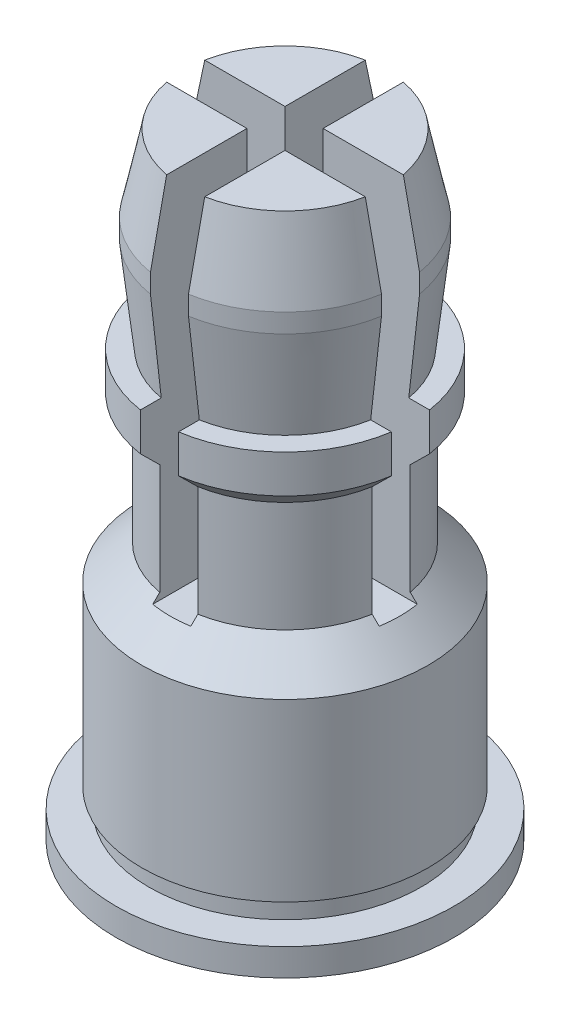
SolidWorks part; units mm, degrees
ref_plane "Plane1" through (0, 0, 0) normal (0, 0, 1) x (1, 0, 0)
ref_plane "Plane2" through (0, 0, 0) normal (0, 1, 0) x (1, 0, 0)
ref_plane "Plane3" through (0, 0, 0) normal (1, 0, 0) x (0, 0, -1)
sketch "BodySke" plane through (0, 0, 0) normal (0, 0, 1) x (1, 0, 0)
  line L0 (2.5555, 0.51) -> (2.5555, 0.8925)
  line L1 (2.69, 4.1891) -> (2.0272, 4.8518)
  line L3 (2.0272, 4.8518) -> (2.0272, 6.9267)
  line L4 (0, 0) -> (3.175, 0)
  line L5 (3.175, 0) -> (3.175, 0.51)
  line L6 (3.175, 0.51) -> (2.5555, 0.51)
  line L7 (2.385, 7.2845) -> (2.385, 8)
  line L8 (2.69, 0.8925) -> (2.69, 4.1891)
  line L9 (0, 0) -> (0, 17.145) construction
  line L10 (2.385, 8) -> (2, 8)
  line L11 (2, 8) -> (2.2, 9.79)
  line L12 (2.2, 9.79) -> (2.2, 10.148)
  line L13 (2.2, 10.148) -> (1.9, 11.58)
  line L14 (1.9, 11.58) -> (0, 11.58)
  line L15 (2.5555, 0.8925) -> (2.69, 0.8925)
  line L17 (0, 11.58) -> (0, 0)
  line L19 (2.385, 7.2845) -> (2.0272, 6.9267)
  dimension "D1" = 315
  dimension "H_dia" = 6.35
  dimension "T_ht" = 0.51
  dimension "C_dia" = 5.38
  dimension "Groove_dia" = 5.111
  dimension "Groove_wid" = 0.3825
  dimension "Length" = 8
  dimension "D_ht" = 3.58
  dimension "Neck_dia" = 4.0545
  dimension "B_dia" = 4.77
  dimension "B_ht" = 0.7155
  dimension "Panel_dia" = 4
  dimension "Slip_dia" = 4.4
  dimension "Tip_dia" = 3.8
  dimension "Grip_ht" = 1.79
  dimension "Slip_ht" = 0.358
  dimension "Neck_len" = 3.1482
revolve "Body" add sketch "BodySke" angle 360 about L9
sketch "SlitCutSke" plane through (0, 11.58, 0) normal (0, 1, 0) x (-1, 0, 0)
  line L0 (-2.6661, 0.3578) -> (2.6661, 0.3578)
  line L1 (2.6661, -0.3578) -> (-2.6661, -0.3578)
  line L2 (-2.6661, 0.3578) -> (-2.6661, -0.3578)
  line L3 (2.6661, 0.3578) -> (2.6661, -0.3578)
  line L4 (-4.064, 0) -> (4.064, 0) construction
  circle A1 centre (0, 0) radius 2.69 construction
  dimension "Width" = 0.7155
extrude "SlitCut" cut sketch "SlitCutSke" against normal blind 6.8582
pattern_circular "SlitCutPat" count 2 every 90 about axis through (0, 0, 0) along (0, 1, 0) of "SlitCut"
ref_plane "Plane4" through (0, -0.5486, 0) normal (0, 1, 0) x (-1, 0, 0)
equation "' \"Panel_dia@BodySke\" = 4"
equation "' \"Length@BodySke\" = 8"
equation "' \"B_dia@BodySke\" = 4.77"
equation "' \"C_dia@BodySke\" = 5.38"
equation "' \"D_ht@BodySke\" = 3.58"
equation "' \"H_dia@BodySke\" = 6.35"
equation "' \"T_ht@BodySke\" = 0.51"
equation "\"Tip_dia@BodySke\" = \"Panel_dia@BodySke\" * 0.95"
equation "\"Slip_dia@BodySke\" = \"Panel_dia@BodySke\" * 1.1"
equation "\"Slip_ht@BodySke\" = \"D_ht@BodySke\" * 0.1"
equation "\"Grip_ht@BodySke\" = \"D_ht@BodySke\" * 0.5"
equation "\"B_ht@BodySke\" = \"B_dia@BodySke\" * 0.15"
equation "\"Neck_dia@BodySke\" = \"B_dia@BodySke\" * 0.85"
equation "\"Neck_len@BodySke\" = \"B_dia@BodySke\" * 0.66"
equation "\"Groove_dia@BodySke\" = \"C_dia@BodySke\" * 0.95"
equation "\"Groove_wid@BodySke\" = \"T_ht@BodySke\" * 0.75"
equation "\"Width@SlitCutSke\" = \"B_ht@BodySke\""
equation "\"Depth@SlitCut\" = \"D_ht@BodySke\" + \"Neck_len@BodySke\" + 0.13"
